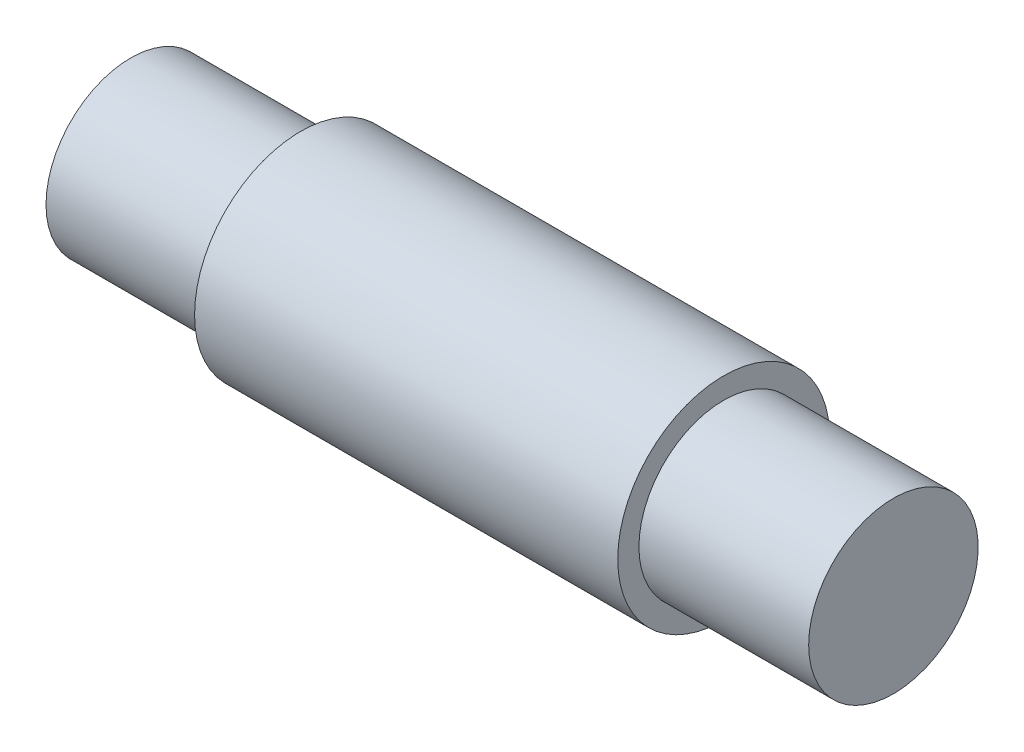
SolidWorks part; units mm, degrees
ref_plane "Front Plane" through (0, 0, 0) normal (0, 0, 1) x (1, 0, 0)
ref_plane "Top Plane" through (0, 0, 0) normal (0, 1, 0) x (1, 0, 0)
ref_plane "Right Plane" through (0, 0, 0) normal (1, 0, 0) x (0, 0, -1)
sketch "Sketch1" plane through (0, 0, 0) normal (0, 0, 1) x (1, 0, 0)
  line L0 (-76.4565, 0) -> (100.0218, 0) construction
  line L1 (-14.2875, 0) -> (-14.2875, 3.175)
  line L2 (-14.2875, 3.175) -> (-7.9275, 3.175)
  line L3 (-7.9275, 3.175) -> (-7.9275, 3.9688)
  line L4 (-7.9275, 3.9688) -> (7.9275, 3.9688)
  line L5 (7.9275, 3.9688) -> (7.9275, 3.175)
  line L6 (7.9275, 3.175) -> (14.2875, 3.175)
  line L7 (14.2875, 3.175) -> (14.2875, 0)
  line L8 (14.2875, 0) -> (-14.2875, 0)
  dimension "D1" = 6.36
  dimension "D2" = 28.575
  dimension "D3" = 7.9375
  dimension "D4" = 6.35
revolve "Revolve1" add sketch "Sketch1" angle 360 about L0
